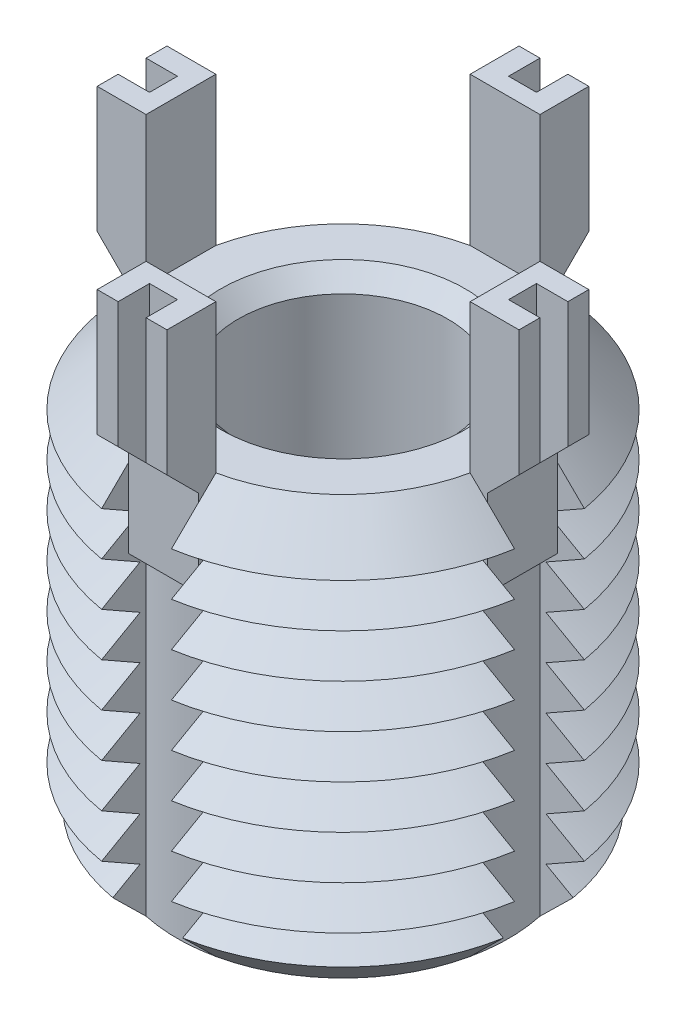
SolidWorks part; units mm, degrees
ref_plane "Front Plane" through (0, 0, 0) normal (0, 0, 1) x (1, 0, 0)
ref_plane "Top Plane" through (0, 0, 0) normal (0, 1, 0) x (1, 0, 0)
ref_plane "Right Plane" through (0, 0, 0) normal (1, 0, 0) x (0, 0, -1)
sketch "Sketch1" plane through (0, 0, 0) normal (0, 1, 0) x (1, 0, 0)
  circle A0 centre (0, 0) radius 6
  dimension "D1" = 12
extrude "Boss-Extrude1" add sketch "Sketch1" against normal blind 12
chamfer "Chamfer1" distance 1.25 angle 45 2 edges at (0, -12, 6) (0, 0, 6)
sketch "Sketch2" plane through (0, 0, 0) normal (1, 0, 0) x (0, 0, -1)
  line L0 (0, 0.8859) -> (0, -9.2617) construction
sketch "Sketch3" plane through (0, 0, 0) normal (1, 0, 0) x (0, 0, -1)
  line L0 (-6, -1.25) -> (-4.9175, -1.875)
  line L1 (-4.9175, -1.875) -> (-6, -2.5)
  line L2 (-6, -1.25) -> (-6, -10.75) construction
  line L3 (-6, -2.5) -> (-6, -1.25)
  dimension "D1" = 1.25
revolve "Cut-Revolve1" cut sketch "Sketch3" angle 360 about L0
pattern_linear "LPattern1" count 8 spacing 1.25 along (0, -1, 0) of "Cut-Revolve1"
sketch "Sketch4" plane through (0, 0, 0) normal (0, 1, 0) x (1, 0, 0)
  line L0 (-4.6435, 1) -> (-5.9161, 1)
  line L2 (-5.9161, -1) -> (-4.6435, -1)
  arc A0 (-4.6435, 1) -> (-4.6435, -1) centre (0, 0) ccw
  arc A1 (-5.9161, 1) -> (-5.9161, -1) centre (0, 0) ccw
  circle A2 centre (0, 0) radius 6 construction
  circle A3 centre (0, 0) radius 4.75 construction
  point P1 (-4.75, 0)
  point P3 (-6, 0)
  point P13 (0, 0)
  dimension "D1" = 2
extrude "Cut-Extrude1" cut sketch "Sketch4" against normal up to surface (12 mm away)
pattern_circular "CirPattern1" count 4 over 360 about axis through (0, 0, 0) along (0, 1, 0) of "Cut-Extrude1"
sketch "Sketch5" plane through (0, 0, 0) normal (1, 0, 0) x (0, 0, -1)
  line L0 (-4.6435, 4.25) -> (-4.6435, -2.75)
  line L1 (-4.6435, -2.75) -> (-5.1435, -2.75)
  line L2 (-5.1435, -2.75) -> (-5.1435, -0.25)
  line L3 (-5.1435, -0.25) -> (-6.0435, 0.65)
  line L4 (-6.0435, 0.65) -> (-6.0435, 4.25)
  line L5 (-6.0435, 4.25) -> (-4.6435, 4.25)
  line L6 (-5.9161, -3.75) -> (-1, -3.75) construction
  point P9 (-1, 0)
  point P10 (-5.1435, -0.25)
  dimension "D1" = 1
  dimension "D2" = 7
  dimension "D3" = 4.5
  dimension "D4" = 1.4
  dimension "D5" = 0.5
  dimension "D6" = 45
extrude "Boss-Extrude3" add sketch "Sketch5" along normal mid plane 2
pattern_circular "CirPattern2" count 4 over 360 about axis through (0, 0, 0) along (0, 1, 0) of "Boss-Extrude3"
sketch "Sketch6" plane through (0, 4.25, 0) normal (0, 1, 0) x (1, 0, 0)
  line L0 (-6.0435, -1) -> (-6.0435, 1) construction
  line L1 (-6.0435, -0.4) -> (-5.1435, -0.4)
  line L2 (-6.0435, -0.4) -> (-6.0435, 0.4)
  line L3 (-6.0435, 0.4) -> (-5.1435, 0.4)
  line L4 (-5.1435, -0.4) -> (-5.1435, 0.4)
  line L5 (-6.0435, -0.4) -> (-5.1435, 0.4) construction
  line L6 (-6.0435, 0.4) -> (-5.1435, -0.4) construction
  line L7 (6.0435, 1) -> (6.0435, -1) construction
  line L8 (-0.4, 5.1435) -> (0.4, 5.1435)
  line L9 (-0.4, 5.1435) -> (-0.4, 6.0435)
  line L10 (-0.4, 6.0435) -> (0.4, 6.0435)
  line L11 (0.4, 5.1435) -> (0.4, 6.0435)
  line L12 (-0.4, 5.1435) -> (0.4, 6.0435) construction
  line L13 (-0.4, 6.0435) -> (0.4, 5.1435) construction
  line L14 (5.1435, -0.4) -> (6.0435, -0.4)
  line L15 (5.1435, -0.4) -> (5.1435, 0.4)
  line L16 (5.1435, 0.4) -> (6.0435, 0.4)
  line L17 (6.0435, -0.4) -> (6.0435, 0.4)
  line L18 (5.1435, -0.4) -> (6.0435, 0.4) construction
  line L19 (5.1435, 0.4) -> (6.0435, -0.4) construction
  line L20 (-0.4, -6.0435) -> (0.4, -6.0435)
  line L21 (-0.4, -6.0435) -> (-0.4, -5.1435)
  line L22 (-0.4, -5.1435) -> (0.4, -5.1435)
  line L23 (0.4, -6.0435) -> (0.4, -5.1435)
  line L24 (-0.4, -6.0435) -> (0.4, -5.1435) construction
  line L25 (-0.4, -5.1435) -> (0.4, -6.0435) construction
  line L26 (-1, 6.0435) -> (1, 6.0435) construction
  line L27 (1, -6.0435) -> (-1, -6.0435) construction
  point P0 (-5.5935, 0)
  point P7 (-6.0435, 0)
  point P8 (-6.0435, 0)
  point P9 (0, 5.5935)
  point P14 (5.5935, 0)
  point P19 (0, -5.5935)
  point P24 (0, 6.0435)
  point P25 (6.0435, 0)
  point P26 (6.0435, 0)
  point P27 (0, 6.0435)
  point P30 (0, -6.0435)
  point P33 (0, -6.0435)
  dimension "D1" = 0.8
  dimension "D2" = 0.9
extrude "Cut-Extrude3" cut sketch "Sketch6" against normal through all both and the other way through all
sketch "Sketch7" plane through (0, 0, 0) normal (0, 1, 0) x (1, 0, 0)
  circle A0 centre (0, 0) radius 3
  dimension "D1" = 6
extrude "Cut-Extrude4" cut sketch "Sketch7" against normal up to surface (12 mm away)
chamfer "Chamfer2" distance 0.5 angle 45 2 edges at (0, 0, 3) (0, -12, 3)
